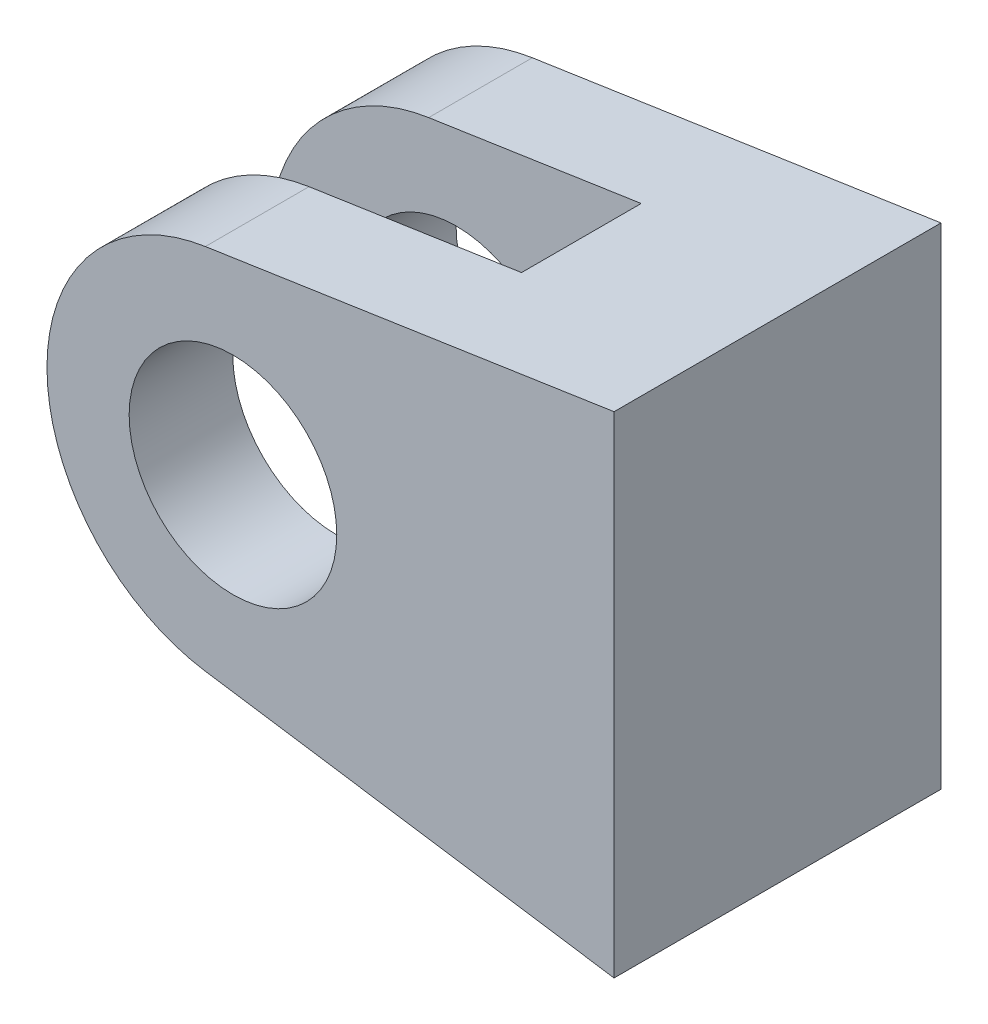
SolidWorks part; units mm, degrees
ref_plane "Front Plane" through (0, 0, 0) normal (0, 0, 1) x (1, 0, 0)
ref_plane "Top Plane" through (0, 0, 0) normal (0, 1, 0) x (1, 0, 0)
ref_plane "Right Plane" through (0, 0, 0) normal (1, 0, 0) x (0, 0, -1)
sketch "Sketch1" plane through (0, 0, 0) normal (0, 0, 1) x (1, 0, 0)
  line L0 (94.2301, 7.2161) -> (94.2301, -22.7839)
  line L1 (94.2301, 7.2161) -> (69.2301, 3.4661)
  line L2 (94.2301, -22.7839) -> (69.2301, -19.0339)
  line L3 (94.2301, -7.7839) -> (29.8059, -7.7839) construction
  arc A0 (69.2301, 3.4661) -> (69.2301, -19.0339) centre (70.9176, -7.7839) ccw
  circle A2 centre (70.9176, -7.7839) radius 6.35
  dimension "D4" = 12.7
  dimension "D1" = 30
  dimension "D2" = 25
  dimension "D3" = 25
  dimension "D5" = 22.5
extrude "Extrude1" add sketch "Sketch1" along normal blind 20
sketch "Sketch2" plane through (0, 0, 0) normal (0, 1, 0) x (1, 0, 0)
  line L0 (94.2301, -20) -> (94.2301, 0) construction
  line L1 (82.2301, -6.34) -> (57.8841, -6.34)
  line L2 (82.2301, -6.34) -> (82.2301, -13.66)
  line L3 (82.2301, -13.66) -> (57.8841, -13.66)
  line L4 (57.8841, -6.34) -> (57.8841, -13.66)
  line L5 (94.2301, -20) -> (94.2301, 0) construction
  line L6 (94.2301, -10) -> (39.4156, -10) construction
  point P8 (82.2301, -10)
  dimension "D1" = 7.32
  dimension "D2" = 12
extrude "Cut-Extrude1" cut sketch "Sketch2" against normal through all and the other way through all
